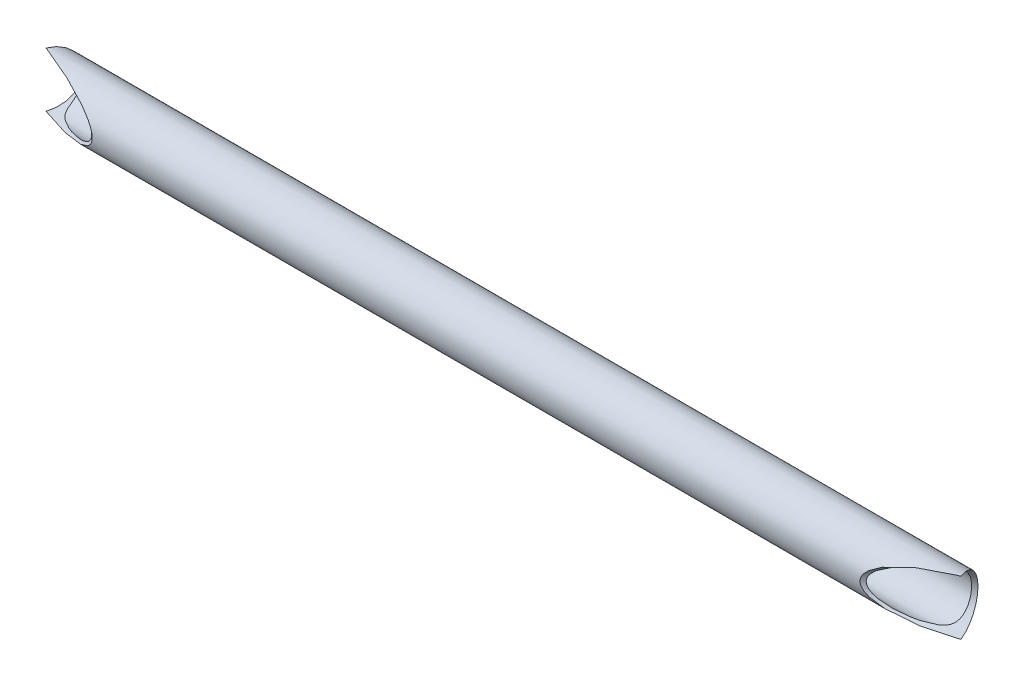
SolidWorks part; units mm, degrees
ref_plane "Plan1" through (0, 0, 0) normal (0, 0, 1) x (1, 0, 0)
ref_plane "Plan2" through (0, 0, 0) normal (0, 1, 0) x (1, 0, 0)
ref_plane "Plan3" through (0, 0, 0) normal (1, 0, 0) x (0, 0, -1)
sketch "Esquisse2" plane through (0, 0, 0) normal (1, 0, 0) x (0, 0, -1)
  circle A0 centre (546, 0) radius 14
  circle A1 centre (546, 0) radius 12.5
  dimension "D1" = 28
  dimension "D2" = 546
  dimension "D3" = 1.5
extrude "Base-Extrusion" add sketch "Esquisse2" along normal up to surface (228.8262 mm away)
sketch "Esquisse3" plane through (0, 0, 0) normal (1, 0, 0) x (0, 0, -1)
  circle A0 centre (546, 0) radius 12.5 construction
  circle A1 centre (546, 0) radius 14
  circle A2 centre (546, 0) radius 14
  circle A3 centre (546, 0) radius 12.5
  dimension "D1" = 0
extrude "Boss.-Extru.1" add sketch "Esquisse3" along normal up to surface (227.0887 mm away)
